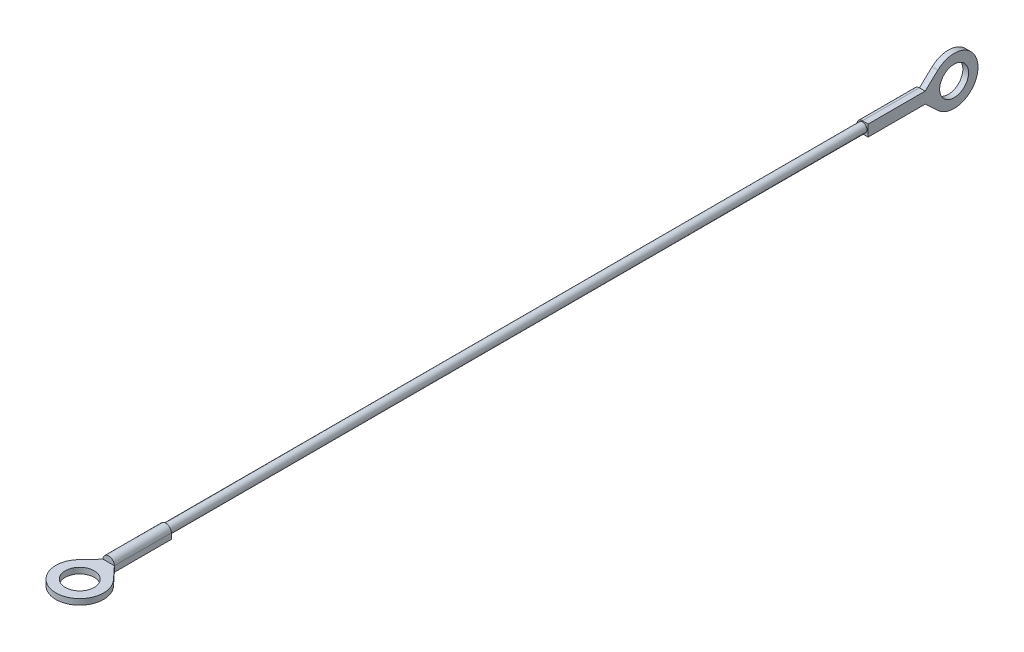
SolidWorks part; units mm, degrees
ref_plane "Front Plane" through (0, 0, 0) normal (0, 0, 1) x (1, 0, 0)
ref_plane "Top Plane" through (0, 0, 0) normal (0, 1, 0) x (1, 0, 0)
ref_plane "Right Plane" through (0, 0, 0) normal (1, 0, 0) x (0, 0, -1)
sketch "Sketch1" plane through (0, 0, 0) normal (0, 0, 1) x (1, 0, 0)
  circle A0 centre (0, 0) radius 0.795
extrude "Boss-Extrude1" add sketch "Sketch1" along normal mid plane 122.24
sketch "Sketch2" plane through (0, 0, 61.12) normal (0, 0, 1) x (1, 0, 0)
  line L0 (-0.995, 0) -> (-0.995, -0.995)
  line L1 (-0.995, -0.995) -> (0, -0.995)
  line L2 (0, -0.995) -> (0.995, -0.995)
  line L3 (0.995, -0.995) -> (0.995, 0)
  arc A0 (0.995, 0) -> (-0.995, 0) centre (0, 0) ccw
  dimension "D1" = 1.99
extrude "Boss-Extrude2" add sketch "Sketch2" along normal blind 10
sketch "Sketch3" plane through (0, -0.995, 0) normal (0, -1, 0) x (1, 0, 0)
  line L0 (0.995, 71.12) -> (3.0665, 73.3447)
  line L1 (-3.0665, 73.3447) -> (-0.995, 71.12)
  line L2 (-0.995, 71.12) -> (0.995, 71.12)
  arc A0 (3.0665, 73.3447) -> (-3.0665, 73.3447) centre (0, 76.2) ccw
  circle A1 centre (0, 76.2) radius 2.54
  point P8 (4.19, 76.2)
  point P9 (-4.19, 76.2)
  dimension "D1" = 5.08
  dimension "D2" = 8.38
  dimension "D3" = 76.2
extrude "Boss-Extrude3" add sketch "Sketch3" against normal blind 1.01
sketch "Sketch4" plane through (0, 0, -61.12) normal (0, 0, -1) x (-1, 0, 0)
  line L0 (0, 0.995) -> (-0.995, 0.995)
  line L1 (-0.995, 0.995) -> (-0.995, 0)
  line L2 (-0.995, 0) -> (-0.995, -0.995)
  line L3 (-0.995, -0.995) -> (0, -0.995)
  arc A0 (0, -0.995) -> (0, 0.995) centre (0, 0) ccw
  dimension "D1" = 1.99
extrude "Boss-Extrude4" add sketch "Sketch4" along normal blind 10
sketch "Sketch5" plane through (0.995, 0, 0) normal (1, 0, 0) x (0, 0, -1)
  line L0 (71.12, -0.995) -> (71.12, 0.995)
  line L1 (71.12, 0.995) -> (73.3447, 3.0665)
  line L2 (73.3447, -3.0665) -> (71.12, -0.995)
  arc A0 (73.3447, 3.0665) -> (73.3447, -3.0665) centre (76.2, 0) cw
  circle A1 centre (76.2, 0) radius 2.54
  point P8 (76.2, 4.19)
  point P9 (76.2, -4.19)
  dimension "D1" = 5.08
  dimension "D2" = 8.38
  dimension "D3" = 76.2
extrude "Boss-Extrude5" add sketch "Sketch5" against normal blind 1.01
